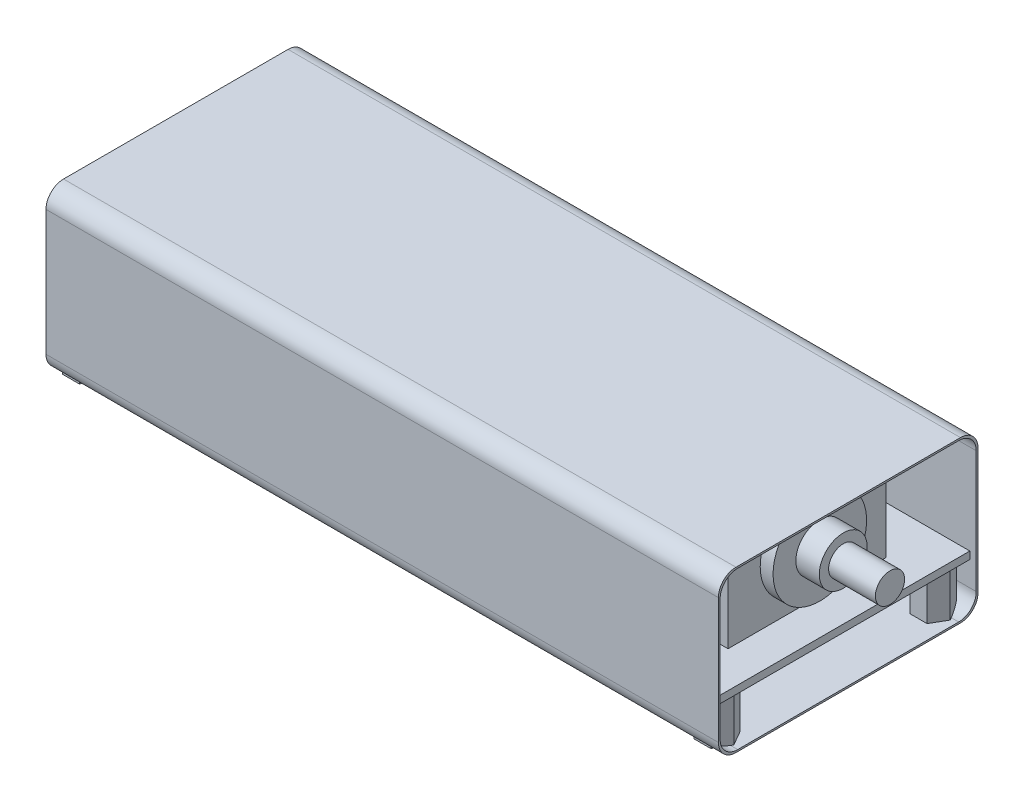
SolidWorks part; units mm, degrees
ref_plane "FRONT" through (0, 0, 0) normal (0, 0, 1) x (1, 0, 0)
ref_plane "TOP" through (0, 0, 0) normal (0, 1, 0) x (1, 0, 0)
ref_plane "RIGHT" through (0, 0, 0) normal (1, 0, 0) x (0, 0, -1)
sketch "Sketch1" plane through (0, 0, 0) normal (0, 1, 0) x (1, 0, 0)
  line L0 (0, 0) -> (145.034, 0)
  line L1 (0, 0) -> (0, 54.991)
  line L2 (145.034, 54.991) -> (0, 54.991)
  line L3 (145.034, 54.991) -> (145.034, 0)
  dimension "D1" = 145.034
  dimension "D2" = 54.991
extrude "Base-Extrude" add sketch "Sketch1" along normal blind 1.6002
sketch "Sketch2" plane through (0, 1.6002, 0) normal (0, 1, 0) x (-1, 0, 0)
  line L0 (0, 0) -> (-87.884, 0)
  line L1 (0, 0) -> (0, -54.991)
  line L2 (-87.884, -54.991) -> (0, -54.991)
  line L3 (-87.884, -54.991) -> (-87.884, 0)
  line L4 (-145.034, -54.991) -> (0, -54.991) construction
  dimension "D1" = 87.884
extrude "Boss-Extrude1" add sketch "Sketch2" along normal blind 12.7
sketch "Sketch16" plane through (0, 0, 0) normal (-1, 0, 0) x (0, 0, 1)
  line L0 (0, 0) -> (-54.991, 0) construction
  line L1 (-37.6555, 8.89) -> (-17.3355, 8.89)
  line L2 (-37.6555, 8.89) -> (-37.6555, 18.034)
  line L3 (-37.6555, 18.034) -> (-17.3355, 18.034)
  line L4 (-17.3355, 8.89) -> (-17.3355, 18.034)
  line L5 (-27.4955, 8.89) -> (-27.4955, 0) construction
  dimension "D1" = 8.89
  dimension "D2" = 9.144
  dimension "D3" = 20.32
extrude "Conn Comm" add sketch "Sketch16" along normal blind 2.54 and the other way blind 6.35
sketch "Sketch17" plane through (0, 1.6002, 0) normal (0, 1, 0) x (-1, 0, 0)
  line L0 (-87.884, -54.991) -> (0, -54.991) construction
  line L1 (-2.54, -52.451) -> (-7.62, -52.451)
  line L2 (-2.54, -52.451) -> (-2.54, -42.291)
  line L3 (-2.54, -42.291) -> (-7.62, -42.291)
  line L4 (-7.62, -52.451) -> (-7.62, -42.291)
  line L5 (-33.02, -7.62) -> (-40.64, -7.62)
  line L6 (-33.02, -7.62) -> (-33.02, -5.08)
  line L7 (-33.02, -5.08) -> (-40.64, -5.08)
  line L8 (-40.64, -7.62) -> (-40.64, -5.08)
  line L9 (0, -37.6555) -> (0, -54.991) construction
  line L10 (0, 0) -> (-87.884, 0) construction
  line L11 (0, 0) -> (0, -17.3355) construction
  dimension "D1" = 10.16
  dimension "D2" = 5.08
  dimension "D3" = 2.54
  dimension "D4" = 2.54
  dimension "D5" = 5.08
  dimension "D6" = 7.62
  dimension "D7" = 2.54
  dimension "D8" = 33.02
extrude "Conn Pins" add sketch "Sketch17" along direction (0, -1, 0) on the side of the normal blind 16.51 separate body
sketch "Sketch14" plane through (0, 0, 0) normal (0, -1, 0) x (1, 0, 0)
  line L1 (57.7366, -8.0534) -> (77.7894, -8.0534)
  line L2 (57.7366, -8.0534) -> (57.7366, -20.7534)
  line L3 (57.7366, -20.7534) -> (77.7894, -20.7534)
  line L4 (77.7894, -8.0534) -> (77.7894, -20.7534)
  line L5 (57.7366, -32.1084) -> (77.7894, -32.1084)
  line L6 (57.7366, -32.1084) -> (57.7366, -44.8084)
  line L7 (57.7366, -44.8084) -> (77.7894, -44.8084)
  line L8 (77.7894, -32.1084) -> (77.7894, -44.8084)
  dimension "D1" = 12.7
extrude "Coils" add sketch "Sketch14" along normal blind 9.525
sketch "Sketch3" plane through (0, 1.6002, 0) normal (0, 1, 0) x (-1, 0, 0)
  line L0 (-117.0305, -27.4955) -> (-145.796, -27.4955) construction
  line L1 (-145.034, -27.4955) -> (-124.714, -27.4955) construction
  line L2 (-145.034, -54.991) -> (-145.034, 0) construction
  line L3 (-137.16, -10.3505) -> (-137.16, -44.6405)
  line L4 (-137.16, -44.6405) -> (-124.714, -44.6405)
  line L5 (-137.16, -10.3505) -> (-124.714, -10.3505)
  line L6 (-124.714, -44.6405) -> (-124.714, -10.3505)
  point P7 (-137.16, -27.4955)
  point P10 (-124.714, -27.4955)
  dimension "D1" = 12.446
  dimension "D2" = 34.29
  dimension "D3" = 20.32
  dimension "D4" = 90
extrude "Boss-Extrude2" add sketch "Sketch3" along normal blind 22.606
ref_plane "Plane4" through (0, 13.5382, 0) normal (0, 1, 0) x (-1, 0, 0)
sketch "Sketch4" plane through (0, 13.5382, 0) normal (0, 1, 0) x (-1, 0, 0)
  line L0 (-137.16, -27.4955) -> (-155.194, -27.4955) construction
  line L1 (-137.16, -10.3505) -> (-137.16, -44.6405) construction
  line L2 (-155.194, -27.4955) -> (-155.194, -30.6705)
  line L3 (-155.194, -30.6705) -> (-145.034, -30.6705)
  line L4 (-145.034, -30.6705) -> (-145.034, -32.7025)
  line L5 (-145.034, -32.7025) -> (-139.954, -32.7025)
  line L6 (-139.954, -32.7025) -> (-139.954, -37.6555)
  line L7 (-139.954, -37.6555) -> (-137.16, -37.6555)
  line L8 (-137.16, -37.6555) -> (-137.16, -27.4955)
  line L9 (-137.16, -27.4955) -> (-155.194, -27.4955)
  point P17 (-155.194, -27.4955)
  dimension "D1" = 3.175
  dimension "D2" = 5.207
  dimension "D3" = 10.16
  dimension "D4" = 10.16
  dimension "D5" = 5.08
  dimension "D6" = 2.794
revolve "Boss-Revolve1" add sketch "Sketch4" angle 360 about L0
sketch "Sketch5" plane through (0, 13.5382, 0) normal (0, 1, 0) x (-1, 0, 0)
  line L0 (-124.714, -27.4955) -> (-108.889, -27.4955) construction
  line L1 (-124.714, -44.6405) -> (-124.714, -10.3505) construction
  line L2 (-124.714, -27.4955) -> (-124.714, -36.3855)
  line L3 (-124.714, -36.3855) -> (-122.936, -36.3855)
  line L4 (-122.936, -36.3855) -> (-122.936, -38.6715)
  line L5 (-122.936, -38.6715) -> (-105.918, -38.6715)
  line L6 (-105.918, -38.6715) -> (-105.918, -31.9405)
  line L7 (-105.918, -31.9405) -> (-96.393, -31.9405)
  line L8 (-96.393, -31.9405) -> (-96.393, -27.4955)
  line L9 (-96.393, -27.4955) -> (-124.714, -27.4955)
  line L10 (-124.714, -44.6405) -> (-124.714, -10.3505) construction
  dimension "D1" = 8.89
  dimension "D2" = 11.176
  dimension "D3" = 4.445
  dimension "D4" = 1.778
  dimension "D5" = 17.018
  dimension "D6" = 9.525
revolve "Boss-Revolve2" add sketch "Sketch5" angle 360 about L0
sketch "Sketch6" plane through (0, 0, 0) normal (0, -1, 0) x (1, 0, 0)
  line L0 (0, 0) -> (145.034, 0) construction
  line L1 (139.2639, -7.1755) -> (142.9301, -7.1755)
  line L2 (142.9301, -7.1755) -> (144.7632, -4.0005)
  line L3 (144.7632, -4.0005) -> (142.9301, -0.8255)
  line L4 (142.9301, -0.8255) -> (139.2639, -0.8255)
  line L5 (139.2639, -0.8255) -> (137.4308, -4.0005)
  line L6 (137.4308, -4.0005) -> (139.2639, -7.1755)
  line L7 (137.4308, -50.9905) -> (139.2639, -54.1655)
  line L8 (139.2639, -54.1655) -> (142.9301, -54.1655)
  line L9 (142.9301, -54.1655) -> (144.7632, -50.9905)
  line L10 (144.7632, -50.9905) -> (142.9301, -47.8155)
  line L11 (142.9301, -47.8155) -> (139.2639, -47.8155)
  line L12 (139.2639, -47.8155) -> (137.4308, -50.9905)
  line L13 (145.034, -54.991) -> (145.034, 0) construction
  line L15 (2.1039, -7.1755) -> (5.7701, -7.1755)
  line L16 (5.7701, -7.1755) -> (7.6032, -4.0005)
  line L17 (7.6032, -4.0005) -> (5.7701, -0.8255)
  line L18 (5.7701, -0.8255) -> (2.1039, -0.8255)
  line L19 (2.1039, -0.8255) -> (0.2708, -4.0005)
  line L20 (0.2708, -4.0005) -> (2.1039, -7.1755)
  line L21 (0.2708, -50.9905) -> (2.1039, -54.1655)
  line L22 (2.1039, -54.1655) -> (5.7701, -54.1655)
  line L23 (5.7701, -54.1655) -> (7.6032, -50.9905)
  line L24 (7.6032, -50.9905) -> (5.7701, -47.8155)
  line L25 (5.7701, -47.8155) -> (2.1039, -47.8155)
  line L26 (2.1039, -47.8155) -> (0.2708, -50.9905)
  line L27 (3.937, -4.0005) -> (141.097, -50.9905) construction
  line L28 (3.937, -4.0005) -> (141.097, -4.0005) construction
  line L29 (3.937, -4.0005) -> (3.937, -50.9905) construction
  line L30 (3.937, -50.9905) -> (141.097, -50.9905) construction
  line L31 (141.097, -4.0005) -> (141.097, -50.9905) construction
  line L32 (0, -54.991) -> (145.034, 0) construction
  circle A0 centre (141.097, -4.0005) radius 3.175 construction
  circle A1 centre (141.097, -50.9905) radius 3.175 construction
  circle A2 centre (3.937, -4.0005) radius 3.175 construction
  circle A3 centre (3.937, -50.9905) radius 3.175 construction
  circle A4 centre (3.937, -4.0005) radius 1.27
  circle A5 centre (141.097, -4.0005) radius 1.27
  circle A6 centre (141.097, -50.9905) radius 1.27
  circle A7 centre (3.937, -50.9905) radius 1.27
  point P38 (72.517, -27.4955)
  dimension "D1" = 6.35
  dimension "D2" = 6.35
  dimension "D4" = 46.99
  dimension "D6" = 6.35
  dimension "D7" = 6.35
  dimension "D3" = 2.54
  dimension "D8" = 137.16
  dimension "D9" = 46.99
extrude "HexStndOff" add sketch "Sketch6" along normal blind 9.525
sketch "Sketch7" plane through (0, 0, 0) normal (1, 0, 0) x (0, 0, -1)
  line L0 (3.556, 24.5872) -> (51.562, 24.5872)
  line L1 (3.175, 24.9682) -> (51.943, 24.9682)
  line L2 (-0.635, 21.1582) -> (-0.635, -6.096)
  line L3 (3.175, -9.906) -> (51.943, -9.906)
  line L4 (55.753, 21.1582) -> (55.753, -6.096)
  line L5 (55.372, 20.7772) -> (55.372, -5.715)
  line L6 (3.556, -9.525) -> (51.562, -9.525)
  line L7 (-0.254, 20.7772) -> (-0.254, -5.715)
  line L8 (44.6405, 24.2062) -> (10.3505, 24.2062) construction
  line L10 (54.991, 14.3002) -> (54.991, 0) construction
  line L12 (47.8155, -9.525) -> (50.9905, -9.525) construction
  arc A1 (51.562, 24.5872) -> (55.372, 20.7772) centre (51.562, 20.7772) cw
  arc A2 (51.943, 24.9682) -> (55.753, 21.1582) centre (51.943, 21.1582) cw
  arc A3 (3.556, 24.5872) -> (-0.254, 20.7772) centre (3.556, 20.7772) ccw
  arc A4 (3.175, 24.9682) -> (-0.635, 21.1582) centre (3.175, 21.1582) ccw
  arc A5 (55.372, -5.715) -> (51.562, -9.525) centre (51.562, -5.715) cw
  arc A6 (51.943, -9.906) -> (55.753, -6.096) centre (51.943, -6.096) ccw
  arc A7 (3.556, -9.525) -> (-0.254, -5.715) centre (3.556, -5.715) cw
  arc A8 (-0.635, -6.096) -> (3.175, -9.906) centre (3.175, -6.096) ccw
  point P14 (55.753, 24.9682)
  point P19 (-0.635, 24.9682)
  point P28 (-0.635, -9.906)
  dimension "D3" = 0.762
  dimension "D4" = 0.762
  dimension "D6" = 3.81
  dimension "D1" = 56.388
  dimension "D5" = 0.381
extrude "Shield" add sketch "Sketch7" along normal blind 146.05
sketch "Fiber ends" plane through (155.194, 0, 0) normal (1, 0, 0) x (0, 0, -1)
  circle A0 centre (25.9715, 13.5382) radius 1.397
  circle A1 centre (29.0195, 13.5382) radius 1.397
  circle A2 centre (27.4955, 13.5382) radius 3.175 construction
  point P0 (27.4955, 13.5382)
  dimension "D1" = 2.794
  dimension "D2" = 1.524
  dimension "D3" = 1.524
sketch "Fiber paths" plane through (0, 13.5382, 0) normal (0, 1, 0) x (-1, 0, 0)
  line L0 (-155.194, -29.0195) -> (-167.894, -29.0195)
  line L1 (-155.194, -25.9715) -> (-167.894, -25.9715)
  line L2 (-155.194, -29.0195) -> (-155.194, -25.9715) construction
  dimension "D1" = 12.7
sketch "Sketch18" plane through (0, -9.906, 0) normal (0, -1, 0) x (1, 0, 0)
  circle A1 centre (3.937, -50.9905) radius 1.27
  circle A2 centre (3.937, -50.9905) radius 1.27
  circle A3 centre (141.097, -50.9905) radius 1.27
  circle A4 centre (141.097, -50.9905) radius 1.27
  circle A5 centre (141.097, -4.0005) radius 1.27
  circle A6 centre (141.097, -4.0005) radius 1.27
  circle A7 centre (3.937, -4.0005) radius 1.27
  circle A8 centre (3.937, -4.0005) radius 1.27
  dimension "D4" = 0
  dimension "D5" = 0
  dimension "D6" = 0
  dimension "D7" = 0
extrude "Cut-Extrude1" cut sketch "Sketch18" against normal blind 6.35
